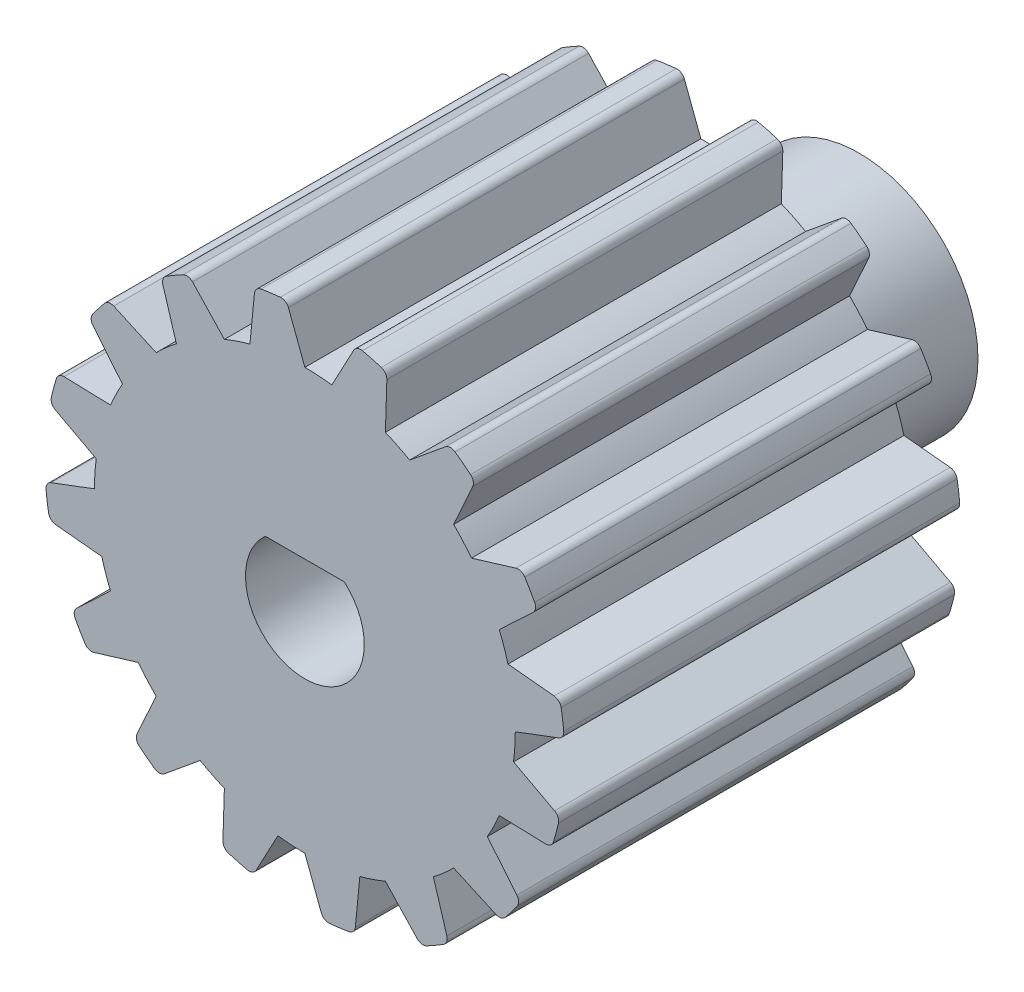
SolidWorks part; units mm, degrees
ref_plane "Alzado" through (0, 0, 0) normal (0, 0, 1) x (1, 0, 0)
ref_plane "Planta" through (0, 0, 0) normal (0, 1, 0) x (1, 0, 0)
ref_plane "Vista lateral" through (0, 0, 0) normal (1, 0, 0) x (0, 0, -1)
sketch "Croquis2" plane through (0, 0, 0) normal (0, 0, 1) x (1, 0, 0)
  line L0 (0, 0) -> (0, 7.9702) construction
  line L2 (-2.0817, 7.6936) -> (-1.9112, 9.4453)
  line L3 (-1.0408, 7.8319) -> (0, 0) construction
  line L4 (0, 7.9702) -> (-0.6221, 9.6166)
  line L5 (1.021, 7.9046) -> (1.8489, 9.4577)
  line L6 (3.0501, 7.3635) -> (3.1053, 9.1227)
  line L7 (3.9682, 6.9122) -> (5.3274, 8.0302)
  line L8 (5.6358, 5.6358) -> (6.3601, 7.2399)
  line L9 (6.3113, 4.8674) -> (7.9949, 5.3803)
  line L10 (7.3635, 3.0501) -> (8.6465, 4.2549)
  line L11 (7.6936, 2.0817) -> (9.4453, 1.9112)
  line L12 (7.9702, 0) -> (9.6166, 0.6221)
  line L13 (7.9046, -1.021) -> (9.4577, -1.8489)
  line L14 (7.3635, -3.0501) -> (9.1227, -3.1053)
  line L15 (6.9122, -3.9682) -> (8.0302, -5.3274)
  line L16 (5.6358, -5.6358) -> (7.2399, -6.3601)
  line L17 (4.8674, -6.3113) -> (5.3803, -7.9949)
  line L18 (3.0501, -7.3635) -> (4.2549, -8.6465)
  line L19 (2.0817, -7.6936) -> (1.9112, -9.4453)
  line L20 (0, -7.9702) -> (0.6221, -9.6166)
  line L21 (-1.021, -7.9046) -> (-1.8489, -9.4577)
  line L22 (-3.0501, -7.3635) -> (-3.1053, -9.1227)
  line L23 (-3.9682, -6.9122) -> (-5.3274, -8.0302)
  line L24 (-5.6358, -5.6358) -> (-6.3601, -7.2399)
  line L25 (-6.3113, -4.8674) -> (-7.9949, -5.3803)
  line L26 (-7.3635, -3.0501) -> (-8.6465, -4.2549)
  line L27 (-7.6936, -2.0817) -> (-9.4453, -1.9112)
  line L28 (-7.9702, 0) -> (-9.6166, -0.6221)
  line L29 (-7.9046, 1.021) -> (-9.4577, 1.8489)
  line L30 (-7.3635, 3.0501) -> (-9.1227, 3.1053)
  line L31 (-6.9122, 3.9682) -> (-8.0302, 5.3274)
  line L32 (-5.6358, 5.6358) -> (-7.2399, 6.3601)
  line L33 (-4.8674, 6.3113) -> (-5.3803, 7.9949)
  line L34 (-3.0501, 7.3635) -> (-4.2549, 8.6465)
  arc A0 (-4.8674, 6.3113) -> (-5.6358, 5.6358) centre (0, 0) ccw
  arc A1 (-7.5914, 6.2764) -> (-8.0413, 5.6886) centre (0, 0) ccw
  arc A2 (-1.6636, 9.7085) -> (-1.9112, 9.4453) centre (-1.6129, 9.4128) ccw
  arc A3 (-0.9298, 9.806) -> (-0.6221, 9.6166) centre (-0.9015, 9.5074) cw
  arc A4 (2.1783, 9.6061) -> (1.8489, 9.4577) centre (2.112, 9.3135) ccw
  arc A5 (2.8935, 9.4154) -> (3.1053, 9.1227) centre (2.8054, 9.1286) cw
  arc A6 (5.6886, 8.0413) -> (5.3274, 8.0302) centre (5.5153, 7.7964) ccw
  arc A7 (6.2764, 7.5914) -> (6.3601, 7.2399) centre (6.0852, 7.3602) cw
  arc A8 (8.3328, 5.2523) -> (7.9949, 5.3803) centre (8.0791, 5.0923) ccw
  arc A9 (8.7037, 4.6117) -> (8.6465, 4.2549) centre (8.4387, 4.4712) cw
  arc A10 (9.7085, 1.6636) -> (9.4453, 1.9112) centre (9.4128, 1.6129) ccw
  arc A11 (9.806, 0.9298) -> (9.6166, 0.6221) centre (9.5074, 0.9015) cw
  arc A12 (9.6061, -2.1783) -> (9.4577, -1.8489) centre (9.3135, -2.112) ccw
  arc A13 (9.4154, -2.8935) -> (9.1227, -3.1053) centre (9.1286, -2.8054) cw
  arc A14 (8.0413, -5.6886) -> (8.0302, -5.3274) centre (7.7964, -5.5153) ccw
  arc A15 (7.5914, -6.2764) -> (7.2399, -6.3601) centre (7.3602, -6.0852) cw
  arc A16 (5.2523, -8.3328) -> (5.3803, -7.9949) centre (5.0923, -8.0791) ccw
  arc A17 (4.6117, -8.7037) -> (4.2549, -8.6465) centre (4.4712, -8.4387) cw
  arc A18 (1.6636, -9.7085) -> (1.9112, -9.4453) centre (1.6129, -9.4128) ccw
  arc A19 (0.9298, -9.806) -> (0.6221, -9.6166) centre (0.9015, -9.5074) cw
  arc A20 (-2.1783, -9.6061) -> (-1.8489, -9.4577) centre (-2.112, -9.3135) ccw
  arc A21 (-2.8935, -9.4154) -> (-3.1053, -9.1227) centre (-2.8054, -9.1286) cw
  arc A22 (-5.6886, -8.0413) -> (-5.3274, -8.0302) centre (-5.5153, -7.7964) ccw
  arc A23 (-6.2764, -7.5914) -> (-6.3601, -7.2399) centre (-6.0852, -7.3602) cw
  arc A24 (-8.3328, -5.2523) -> (-7.9949, -5.3803) centre (-8.0791, -5.0923) ccw
  arc A25 (-8.7037, -4.6117) -> (-8.6465, -4.2549) centre (-8.4387, -4.4712) cw
  arc A26 (-9.7085, -1.6636) -> (-9.4453, -1.9112) centre (-9.4128, -1.6129) ccw
  arc A27 (-9.806, -0.9298) -> (-9.6166, -0.6221) centre (-9.5074, -0.9015) cw
  arc A28 (-9.6061, 2.1783) -> (-9.4577, 1.8489) centre (-9.3135, 2.112) ccw
  arc A29 (-9.4154, 2.8935) -> (-9.1227, 3.1053) centre (-9.1286, 2.8054) cw
  arc A30 (-8.0413, 5.6886) -> (-8.0302, 5.3274) centre (-7.7964, 5.5153) ccw
  arc A31 (-7.5914, 6.2764) -> (-7.2399, 6.3601) centre (-7.3602, 6.0852) cw
  arc A32 (-5.2523, 8.3328) -> (-5.3803, 7.9949) centre (-5.0923, 8.0791) ccw
  arc A33 (-4.6117, 8.7037) -> (-4.2549, 8.6465) centre (-4.4712, 8.4387) cw
  arc A34 (-4.6117, 8.7037) -> (-5.2523, 8.3328) centre (0, 0) ccw
  arc A35 (-0.9298, 9.806) -> (-1.6636, 9.7085) centre (0, 0) ccw
  arc A36 (2.8935, 9.4154) -> (2.1783, 9.6061) centre (0, 0) ccw
  arc A37 (6.2764, 7.5914) -> (5.6886, 8.0413) centre (0, 0) ccw
  arc A38 (8.7037, 4.6117) -> (8.3328, 5.2523) centre (0, 0) ccw
  arc A39 (9.4154, -2.8935) -> (9.6061, -2.1783) centre (0, 0) ccw
  arc A40 (7.5914, -6.2764) -> (8.0413, -5.6886) centre (0, 0) ccw
  arc A41 (-9.4154, 2.8935) -> (-9.6061, 2.1783) centre (0, 0) ccw
  arc A42 (-9.806, -0.9298) -> (-9.7085, -1.6636) centre (0, 0) ccw
  arc A43 (-8.7037, -4.6117) -> (-8.3328, -5.2523) centre (0, 0) ccw
  arc A44 (-6.2764, -7.5914) -> (-5.6886, -8.0413) centre (0, 0) ccw
  arc A45 (-2.8935, -9.4154) -> (-2.1783, -9.6061) centre (0, 0) ccw
  arc A46 (0.9298, -9.806) -> (1.6636, -9.7085) centre (0, 0) ccw
  arc A47 (4.6117, -8.7037) -> (5.2523, -8.3328) centre (0, 0) ccw
  arc A48 (-2.0817, 7.6936) -> (-3.0501, 7.3635) centre (0, 0) ccw
  arc A49 (1.021, 7.9046) -> (0, 7.9702) centre (0, 0) ccw
  arc A50 (3.9682, 6.9122) -> (3.0501, 7.3635) centre (0, 0) ccw
  arc A51 (6.3113, 4.8674) -> (5.6358, 5.6358) centre (0, 0) ccw
  arc A52 (7.6936, 2.0817) -> (7.3635, 3.0501) centre (0, 0) ccw
  arc A53 (7.9046, -1.021) -> (7.9702, 0) centre (0, 0) ccw
  arc A54 (9.806, 0.9298) -> (9.7085, 1.6636) centre (0, 0) ccw
  arc A55 (6.9122, -3.9682) -> (7.3635, -3.0501) centre (0, 0) ccw
  arc A56 (4.8674, -6.3113) -> (5.6358, -5.6358) centre (0, 0) ccw
  arc A57 (2.0817, -7.6936) -> (3.0501, -7.3635) centre (0, 0) ccw
  arc A58 (-1.021, -7.9046) -> (0, -7.9702) centre (0, 0) ccw
  arc A59 (-3.9682, -6.9122) -> (-3.0501, -7.3635) centre (0, 0) ccw
  arc A60 (-6.3113, -4.8674) -> (-5.6358, -5.6358) centre (0, 0) ccw
  arc A61 (-7.6936, -2.0817) -> (-7.3635, -3.0501) centre (0, 0) ccw
  arc A62 (-7.9046, 1.021) -> (-7.9702, 0) centre (0, 0) ccw
  arc A63 (-6.9122, 3.9682) -> (-7.3635, 3.0501) centre (0, 0) ccw
  dimension "D1" = 2.1
  dimension "D2" = 19.7
  dimension "D3" = 15.9404
  dimension "D6" = 0.6
  dimension "D4" = 1.76
extrude "Saliente-Extruir1" add sketch "Croquis2" along normal blind 15
sketch "Croquis3" plane through (0, 0, 15) normal (0, 0, 1) x (1, 0, 0)
  line L0 (0, 0) -> (0, 1.68) construction
  line L1 (-1.4967, 1.68) -> (1.4967, 1.68)
  arc A0 (-1.4967, 1.68) -> (1.4967, 1.68) centre (0, 0) ccw
  point P7 (0, 1.68)
  dimension "D1" = 4.5
  dimension "D2" = 1.68
sketch "Croquis5" plane through (0, 0, 0) normal (0, 0, -1) x (-1, 0, 0)
  circle A0 centre (0, 0) radius 4.5
  dimension "D1" = 9
extrude "Saliente-Extruir2" add sketch "Croquis5" along normal blind 6
extrude "Cortar-Extruir1" cut sketch "Croquis3" against normal through all
